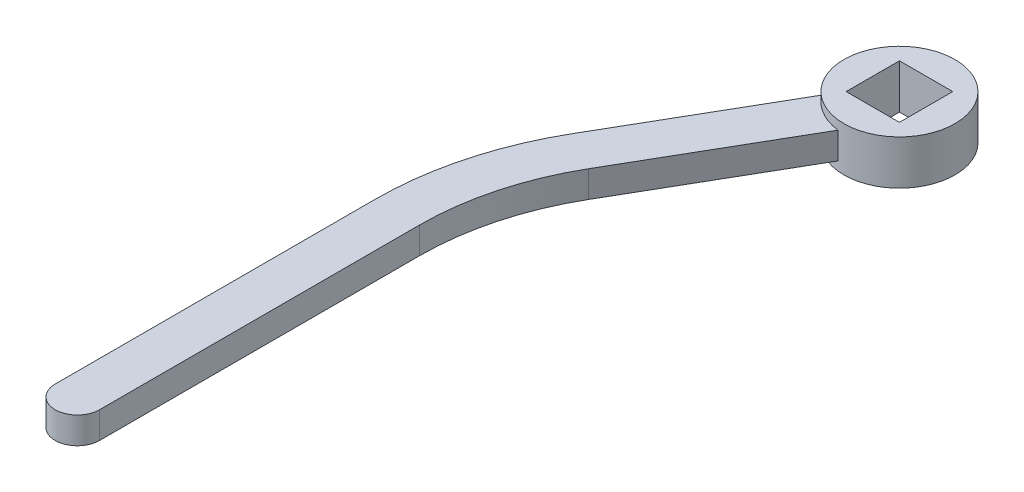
SolidWorks part; units mm, degrees
ref_plane "Front" through (0, 0, 0) normal (0, 0, 1) x (1, 0, 0)
ref_plane "Top" through (0, 0, 0) normal (0, 1, 0) x (1, 0, 0)
ref_plane "Right" through (0, 0, 0) normal (1, 0, 0) x (0, 0, -1)
sketch "Sketch1" plane through (0, 0, 0) normal (0, 1, 0) x (1, 0, 0)
  line L0 (0, 0) -> (0, 71.9615) construction
  line L1 (8.7083, 104.4615) -> (35, 150) construction
  line L2 (4.3782, 106.9615) -> (30.6699, 152.5)
  line L3 (-5, 0) -> (-5, 71.9615)
  line L4 (13.0385, 101.9615) -> (39.3301, 147.5)
  line L5 (5, 0) -> (5, 71.9615)
  line L6 (30.6699, 152.5) -> (39.3301, 147.5)
  arc A0 (0, 71.9615) -> (8.7083, 104.4615) centre (65, 71.9615) cw construction
  arc A1 (-5, 71.9615) -> (4.3782, 106.9615) centre (65, 71.9615) cw
  arc A2 (5, 71.9615) -> (13.0385, 101.9615) centre (65, 71.9615) cw
  arc A3 (-5, 0) -> (5, 0) centre (0, 0) ccw
  dimension "D2" = 65
  dimension "D1" = 150
  dimension "D3" = 150
  dimension "D4" = 35
  dimension "HalfThickness" = 5
extrude "handle" add sketch "Sketch1" along normal mid plane 6
sketch "Sketch2" plane through (0, 0, 0) normal (0, 1, 0) x (1, 0, 0)
  line L0 (39.3301, 147.5) -> (30.6699, 152.5) construction
  circle A0 centre (35, 150) radius 12.5
  dimension "D1" = 25
extrude "end" add sketch "Sketch2" along normal mid plane 10
sketch "Sketch3" plane through (0, 5, 0) normal (0, 1, 0) x (-1, 0, 0)
  line L1 (-39.6188, -142) -> (-44.2376, -150)
  line L2 (-44.2376, -150) -> (-39.6188, -158)
  line L3 (-39.6188, -158) -> (-30.3812, -158)
  line L4 (-30.3812, -158) -> (-25.7624, -150)
  line L5 (-25.7624, -150) -> (-30.3812, -142)
  line L6 (-30.3812, -142) -> (-39.6188, -142)
  circle A0 centre (-35, -150) radius 8 construction
  dimension "D1" = 16
extrude "hex-cut" cut sketch "Sketch3" against normal through all
sketch "Sketch4" plane through (0, 5, 0) normal (0, 1, 0) x (-1, 0, 0)
  line L0 (-29, -144) -> (-41, -156) construction
  line L1 (-29, -156) -> (-41, -156)
  line L2 (-29, -156) -> (-29, -144)
  line L3 (-29, -144) -> (-41, -144)
  line L4 (-41, -156) -> (-41, -144)
  circle A1 centre (-35, -150) radius 12.5 construction
  point P4 (-35, -150)
  dimension "D1" = 12
extrude "square-cut" cut sketch "Sketch4" against normal through all
